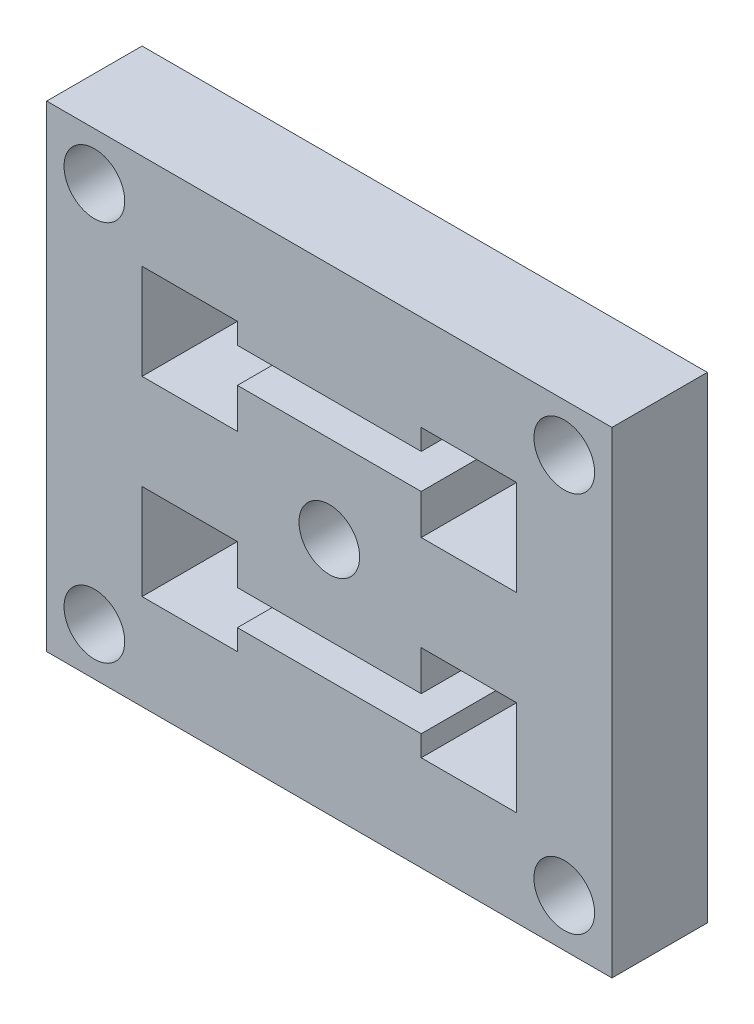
SolidWorks part; units mm, degrees
ref_plane "Front Plane" through (0, 0, 0) normal (0, 0, 1) x (1, 0, 0)
ref_plane "Top Plane" through (0, 0, 0) normal (0, 1, 0) x (1, 0, 0)
ref_plane "Right Plane" through (0, 0, 0) normal (1, 0, 0) x (0, 0, -1)
sketch "Sketch1" plane through (0, 0, 0) normal (0, 0, 1) x (1, 0, 0)
  line L0 (0, 0) -> (-10.6, 0) construction
  line L1 (-10.6, 0) -> (-10.6, 12.1) construction
  line L2 (-10.6, 12.1) -> (0, 12.1) construction
  line L3 (0, 12.1) -> (0, 0) construction
  line L4 (-10.6, 13.1) -> (-10.6, 11.1) construction
  line L5 (-10.6, -1.5) -> (0, -1.5) construction
  line L6 (0, -1.5) -> (0, 0) construction
  line L7 (-10.6, 0) -> (-10.6, 3.3) construction
  line L8 (0, 13.6) -> (-10.6, 13.6) construction
  line L9 (0, 12.1) -> (0, 8.8) construction
  line L10 (-5.3, -1.5) -> (-5.3, 13.6) construction
  line L11 (0, 8.8) -> (0, 3.3) construction
  line L12 (0, 3.3) -> (0, -2.2) construction
  line L13 (0, -2.2) -> (5.5, -2.2) construction
  line L14 (5.5, -2.2) -> (5.5, 3.3) construction
  line L15 (5.5, 3.3) -> (0, 3.3) construction
  line L16 (0, 8.8) -> (5.5, 8.8) construction
  line L17 (5.5, 8.8) -> (5.5, 14.3) construction
  line L18 (5.5, 14.3) -> (0, 14.3) construction
  line L19 (0, 14.3) -> (0, 13.6) construction
  line L20 (-10.6, 8.8) -> (-16.1, 8.8) construction
  line L21 (-16.1, 8.8) -> (-16.1, 14.3) construction
  line L22 (-16.1, 14.3) -> (-10.6, 14.3) construction
  line L23 (-10.6, 14.3) -> (-10.6, 13.6) construction
  line L24 (-10.6, 3.3) -> (-16.1, 3.3) construction
  line L25 (-16.1, 3.3) -> (-16.1, -2.2) construction
  line L26 (-16.1, -2.2) -> (-10.6, -2.2) construction
  line L27 (-10.6, -2.2) -> (-10.6, -1.5) construction
  line L28 (-16.1, 14.3) -> (-16.1, 19.8) construction
  line L29 (-16.1, 19.8) -> (5.5, 19.8) construction
  line L30 (5.5, 19.8) -> (11, 19.8) construction
  line L31 (11, 19.8) -> (11, -2.2) construction
  line L32 (11, -2.2) -> (11, -7.7) construction
  line L33 (11, -7.7) -> (-16.1, -7.7) construction
  line L34 (-16.1, -7.7) -> (-21.6, -7.7) construction
  line L35 (-21.6, -7.7) -> (-21.6, 19.8) construction
  line L36 (-21.6, 19.8) -> (-16.1, 19.8) construction
  line L37 (-21.6, -7.7) -> (-16.1, -2.2) construction
  line L38 (11, 19.8) -> (-21.6, 19.8) construction
  line L39 (5.5, -2.2) -> (11, -7.7) construction
  line L40 (-16.1, 14.3) -> (-21.6, 14.3) construction
  line L41 (-21.6, 14.3) -> (-16.1, 19.8) construction
  line L42 (5.5, 19.8) -> (5.5, 14.3) construction
  line L43 (5.5, 14.3) -> (11, 14.3) construction
  line L44 (11, 14.3) -> (5.5, 19.8) construction
  line L45 (-16.1, -7.7) -> (-16.1, -2.2) construction
  line L46 (-16.1, -2.2) -> (-21.6, -2.2) construction
  line L47 (-21.6, -2.2) -> (-16.1, -7.7) construction
  line L48 (5.5, -2.2) -> (11, -2.2) construction
  line L49 (5.5, -2.2) -> (5.5, -7.7) construction
  line L50 (5.5, -7.7) -> (11, -2.2) construction
  line L51 (5.5, 14.3) -> (11, 19.8) construction
  line L52 (-21.6, 19.8) -> (-16.1, 14.3) construction
  line L53 (-21.6, 19.8) -> (11, 19.8)
  line L54 (11, 19.8) -> (11, -7.7)
  line L55 (11, -7.7) -> (-21.6, -7.7)
  line L56 (-21.6, -7.7) -> (-21.6, 19.8)
  line L58 (-10.6, 8.8) -> (-16.1, 8.8)
  line L59 (-16.1, 8.8) -> (-16.1, 14.3)
  line L60 (-16.1, 14.3) -> (-10.6, 14.3)
  line L61 (0, 14.3) -> (5.5, 14.3)
  line L62 (5.5, 14.3) -> (5.5, 8.8)
  line L63 (5.5, 8.8) -> (0, 8.8)
  line L65 (-16.1, 3.3) -> (-10.6, 3.3)
  line L67 (-10.6, -2.2) -> (-16.1, -2.2)
  line L68 (-16.1, -2.2) -> (-16.1, 3.3)
  line L74 (0, 3.3) -> (5.5, 3.3)
  line L75 (5.5, 3.3) -> (5.5, -2.2)
  line L76 (5.5, -2.2) -> (0, -2.2)
  line L79 (-10.6, 12.1) -> (-10.6, 8.8) construction
  line L83 (-10.6, 8.8) -> (-10.6, 11.1)
  line L84 (-10.6, 11.1) -> (0, 11.1)
  line L85 (0, 11.1) -> (0, 8.8)
  line L86 (-10.6, 14.3) -> (-10.6, 13.1)
  line L87 (-10.6, 13.1) -> (0, 13.1)
  line L88 (0, 13.1) -> (0, 14.3)
  line L89 (-10.6, -1) -> (-10.6, 1) construction
  line L90 (-10.6, 3.3) -> (-10.6, 1)
  line L91 (-10.6, 1) -> (0, 1)
  line L92 (0, 1) -> (0, 3.3)
  line L93 (-10.6, -2.2) -> (-10.6, -1)
  line L94 (-10.6, -1) -> (0, -1)
  line L95 (0, -1) -> (0, -2.2)
  circle A0 centre (-5.3, 6.05) radius 1.75
  circle A1 centre (-18.85, -4.95) radius 1.75
  circle A2 centre (-18.85, 17.05) radius 1.75
  circle A3 centre (8.25, 17.05) radius 1.75
  circle A4 centre (8.25, -4.95) radius 1.75
  point P14 (0, 6.05)
  point P55 (-10.6, 12.1)
  point P58 (-10.6, 0)
  dimension "D5" = 3.5
  dimension "D6" = 27.5
  dimension "D1" = 10.6
  dimension "D2" = 12.1
  dimension "D3" = 1.5
  dimension "D4" = 1.5
  dimension "D7" = 32.6
extrude "Boss-Extrude1" add sketch "Sketch1" along normal blind 5.5
